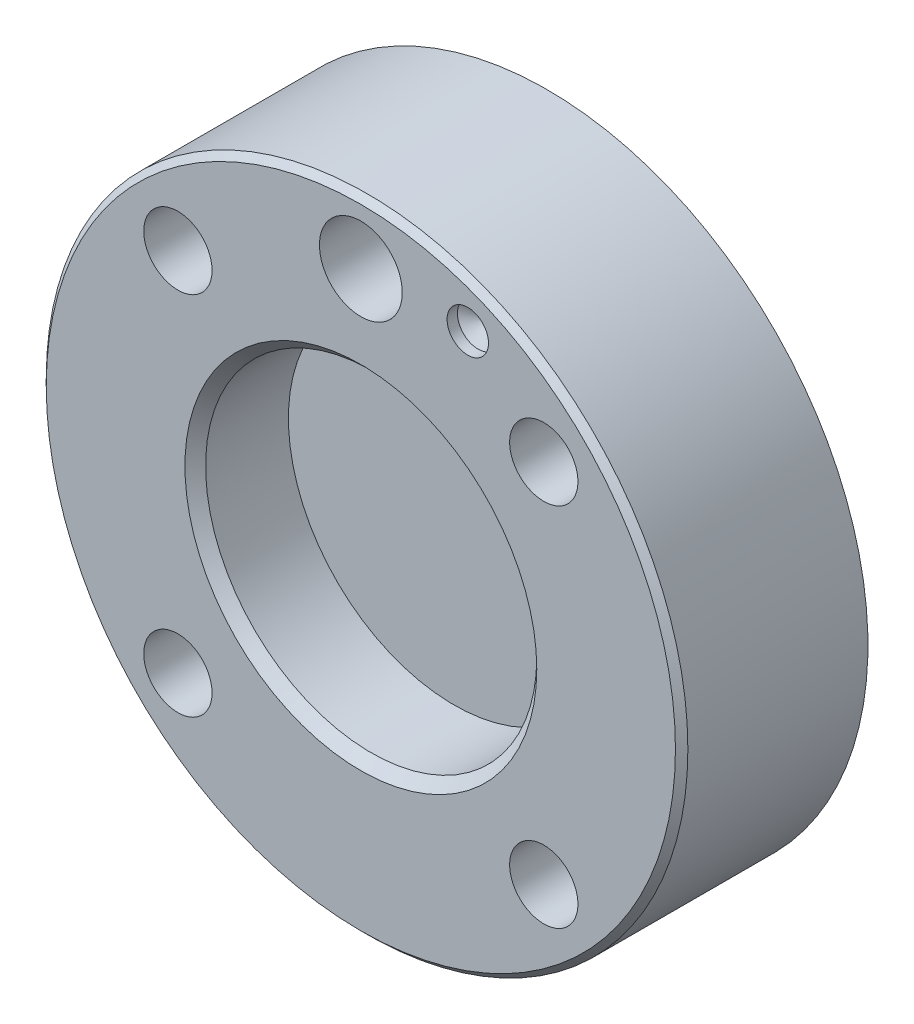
SolidWorks part; units mm, degrees
ref_plane "Front" through (0, 0, 0) normal (0, 0, 1) x (1, 0, 0)
ref_plane "Top" through (0, 0, 0) normal (0, 1, 0) x (1, 0, 0)
ref_plane "Right" through (0, 0, 0) normal (1, 0, 0) x (0, 0, -1)
imported_body "Imported1"
sketch "Sketch1" plane through (0, 0, 36) normal (0, 0, 1) x (1, 0, 0)
  circle A0 centre (0, 12.5) radius 2 construction
  circle A1 centre (-8.8388, 8.8388) radius 1.65 construction
  circle A2 centre (-8.8388, -8.8388) radius 1.65 construction
  circle A3 centre (8.8388, -8.8388) radius 1.65 construction
  circle A4 centre (8.8388, 8.8388) radius 1.65 construction
  circle A5 centre (0, 12.5) radius 2
  circle A6 centre (-8.8388, 8.8388) radius 1.65
  circle A7 centre (-8.8388, -8.8388) radius 1.65
  circle A8 centre (8.8388, -8.8388) radius 1.65
  circle A9 centre (8.8388, 8.8388) radius 1.65
extrude "Extrude1" add sketch "Sketch1" against normal up to surface (9 mm away)
hole_wizard "M4 Tapped Hole1" positions "Sketch3" profile "Sketch2" tap size "M4" standard "DIN"
sketch "Sketch3" plane through (0, 0, 36) normal (0, 0, 1) x (1, 0, 0)
  line L0 (-8.8388, 8.8388) -> (8.8388, -8.8388) construction
  line L1 (8.8388, 8.8388) -> (0, 0) construction
  point P0 (-8.8388, 8.8388)
  point P2 (8.8388, 8.8388)
  point P4 (8.8388, -8.8388)
  point P6 (-8.8388, -8.8388)
  dimension "D1" = 25
sketch "Sketch2" plane through (-8.8388, 8.8388, 36) normal (1, 0, 0) x (0, -1, 0)
  line L0 (0, 0) -> (0, 8.4914)
  line L1 (0, 8.4914) -> (1.65, 7.5)
  line L2 (1.65, 7.5) -> (1.65, 0)
  line L5 (1.65, 0) -> (0, 0)
  line L10 (0, 8.4914) -> (-1.65, 7.5) construction
  line L11 (0, -6.35) -> (0, 107.95) construction
  dimension "Tap Drill Dia." = 3.3
  dimension "Tap Drill Depth" = 7.5
  dimension "Drill Angle" = 118
hole_wizard "Ø4.0 (4) Diameter Hole1" positions "Sketch5" profile "Sketch4" hole size "Ø4.0" standard "ISO"
sketch "Sketch5" plane through (0, 0, 36) normal (0, 0, 1) x (1, 0, 0)
  circle A0 centre (0, 0) radius 8 construction
  point P0 (0, 12.5)
  dimension "D1" = 12.5
sketch "Sketch4" plane through (0, 12.5, 36) normal (1, 0, 0) x (0, -1, 0)
  line L0 (0, 0) -> (0, 5.2017)
  line L1 (0, 5.2017) -> (2, 4)
  line L2 (2, 4) -> (2, 0)
  line L5 (2, 0) -> (0, 0)
  line L10 (0, 5.2017) -> (-2, 4) construction
  line L11 (0, -6.35) -> (0, 107.95) construction
  dimension "Hole Dia." = 4
  dimension "Hole Depth" = 4
  dimension "Drill Angle" = 118
